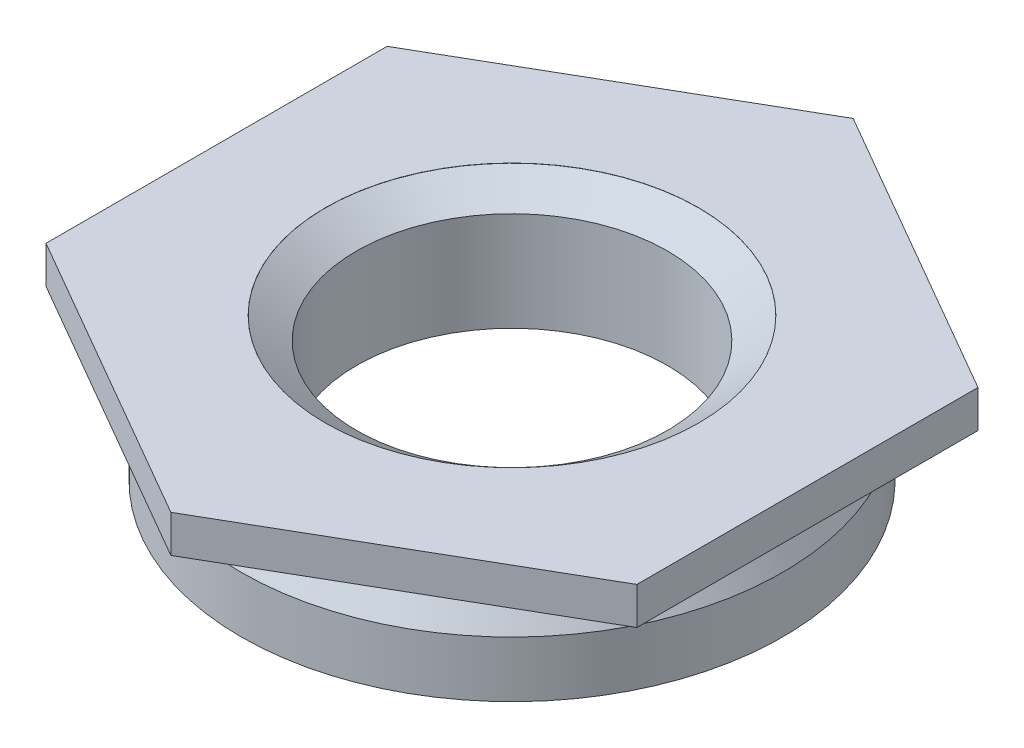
SolidWorks part; units mm, degrees
ref_plane "Plane1" through (0, 0, 0) normal (0, 0, 1) x (1, 0, 0)
ref_plane "Plane2" through (0, 0, 0) normal (0, 1, 0) x (1, 0, 0)
ref_plane "Plane3" through (0, 0, 0) normal (1, 0, 0) x (0, 0, -1)
sketch "BodySke" plane through (0, 0, 0) normal (0, 0, 1) x (1, 0, 0)
  line L0 (4.0663, 0) -> (5.5095, 0)
  line L1 (5.5095, 0) -> (5.5095, 0.6)
  line L2 (5.5095, 0.6) -> (2.5, 0.6)
  line L3 (2.5, 0.6) -> (2.5, -1.7)
  line L4 (2.5, -1.7) -> (4.355, -1.7)
  line L5 (4.355, -1.7) -> (4.355, -0.8)
  line L6 (4.355, -0.8) -> (4.0663, -0.3)
  line L7 (1.016, 1) -> (3.6522, 1) construction
  line L9 (0, 0) -> (0, 15.24) construction
  line L10 (4.0663, -0.3) -> (4.0663, 0)
  dimension "D1" = 60
  dimension "E_dia" = 11.019
  dimension "C_dia" = 8.71
  dimension "A_ht" = 1.7
  dimension "Thread_min" = 5
  dimension "C_len" = 0.9
  dimension "Clinching_ht" = 0.3
  dimension "Advance" = 1
  dimension "Thickness" = 2.3
revolve "Body" add sketch "BodySke"
revolve "EndChamfer" cut sketch "EndChamferSke" angle 360 about L0
sketch "EndChamferSke" plane through (0, 0, 0) normal (0, 0, 1) x (1, 0, 0)
  line L0 (0, -2.54) -> (0, 7.62) construction
  line L1 (0, 0) -> (0, 15.24) construction
  line L2 (3, -1.954) -> (3, -1.6975)
  line L3 (3, -1.6975) -> (2.5, -1.3475)
  line L4 (2.5, -1.3475) -> (2.5, -1.954)
  line L5 (2.5, -1.954) -> (3, -1.954)
  line L6 (3, 0.5975) -> (2.5, 0.2475)
  line L7 (3, 0.5975) -> (3, 0.854)
  line L8 (2.5, 0.2475) -> (2.5, 0.854)
  line L9 (3, 0.854) -> (2.5, 0.854)
  line L11 (-4.355, -1.7) -> (4.355, -1.7) construction
  line L12 (5.5095, 0.6) -> (-5.5095, 0.6) construction
  dimension "D1" = 0.254
  dimension "Thread_nominal" = 6
  dimension "D2" = 34.99
  dimension "D3" = 0.254
  dimension "Thread_min" = 5
  dimension "Inset" = 0.0025
  dimension "Inset_far" = 0.0025
ref_plane "Plane4" through (0, -0.5486, 0) normal (0, 1, 0) x (-1, 0, 0)
sketch "ThdSchSke" plane through (0, 0, 0) normal (0, 0, 1) x (1, 0, 0)
  line L0 (0, -5.08) -> (0, 7.62) construction
  line L1 (0, 0) -> (0, 15.24) construction
  line L2 (0, -1.6975) -> (3, -1.6975) construction
  line L4 (3, -1.6975) -> (2.5, -1.3474)
  line L6 (3, -1.6975) -> (2.5, -2.0476)
  line L7 (2.5, -1.3474) -> (2.5, -2.0476)
  line L8 (3, -1.6975) -> (-3, -1.6975) construction
  dimension "Vee_angle" = 70
  dimension "Thread_nominal" = 6
  dimension "Thread_min" = 5
revolve "ThreadSchematic" [suppressed] cut sketch "ThdSchSke" angle 360 about L0
pattern_linear "ThdSchPat" [suppressed]
sketch "HexDieSke" plane through (0, 0.6, 0) normal (0, 1, 0) x (-1, 0, 0)
  line L0 (0, 5.4848) -> (4.75, 2.7424)
  line L1 (4.75, 2.7424) -> (4.75, -2.7424)
  line L2 (4.75, -2.7424) -> (0, -5.4848)
  line L3 (0, -5.4848) -> (-4.75, -2.7424)
  line L4 (-4.75, -2.7424) -> (-4.75, 2.7424)
  line L5 (-4.75, 2.7424) -> (0, 5.4848)
  circle A1 centre (0, 0) radius 4.75 construction
  circle A2 centre (0, 0) radius 5.4848 construction
  circle A3 centre (0, 0) radius 5.5105
  dimension "Width_across_flats" = 9.5
  dimension "OD" = 11.021
extrude "HexDie" cut sketch "HexDieSke" against normal blind 0.6
equation "' \"Thickness@BodySke\" = 2.3"
equation "' \"C_dia@BodySke\" = 8.71"
equation "' \"Width_across_flats@HexDieSke\" = 9.5"
equation "' \"Advance@BodySke\" = 1"
equation "' \"Thread_min@BodySke\" = 5"
equation "' \"Thread_nominal@ThreadCosmetic\" = 6"
equation "\"OD@HexDieSke\" =  \"Width_across_flats@HexDieSke\" * 1.16 + 0.001"
equation "\"E_dia@BodySke\" = \"Width_across_flats@HexDieSke\" * 1.16 - 0.001"
equation "\"A_ht@BodySke\" = \"Thickness@BodySke\" - 1.5 * 0.4"
equation "\"Depth@HexDie\" = \"Thickness@BodySke\" - \"A_ht@BodySke\""
equation "\"Clinching_ht@BodySke\" = 0.3"
equation "\"C_len@BodySke\" =  \"Thickness@BodySke\" - 1.4"
equation "\"Thread_nominal@EndChamferSke\" = \"Thread_nominal@ThreadCosmetic\""
equation "\"Thread_min@EndChamferSke\" = \"Thread_min@BodySke\""
equation "\"D2@EndChamferSke\" = \"Vee_angle@ThdSchSke\" / 2 - 0.01"
equation "\"Thread_nominal@ThdSchSke\" = \"Thread_nominal@ThreadCosmetic\""
equation "\"Thread_min@ThdSchSke\" = \"Thread_min@BodySke\""
equation "\"Num_threads@ThdSchPat\" = int(  ( \"Thickness@BodySke\" - \"Inset@EndChamferSke\" - \"Inset_far@EndChamferSke\" ) / \"Advance@BodySke\" + 0.999 )  + 1"
equation "\"Advance@ThdSchPat\" = (  \"Thickness@BodySke\" - \"Inset@EndChamferSke\" - \"Inset_far@EndChamferSke\"  ) /  (\"Num_threads@ThdSchPat\" - 1) 'relax it"
